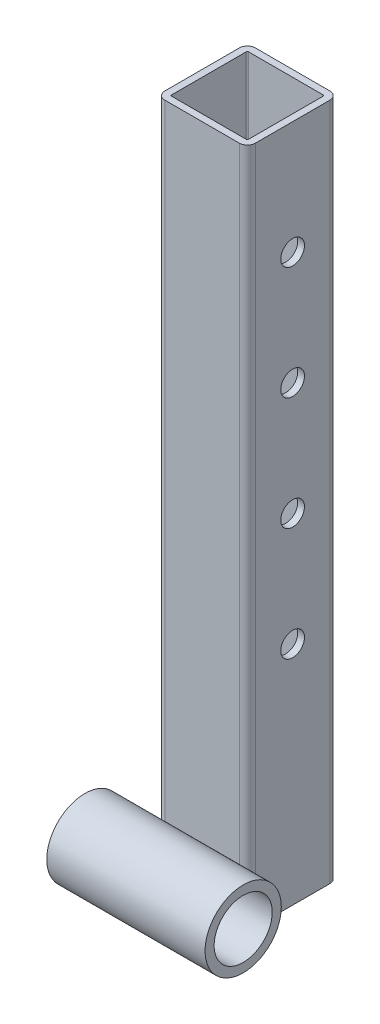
SolidWorks part; units mm, degrees
ref_plane "Plan de face" through (0, 0, 0) normal (0, 0, 1) x (1, 0, 0)
ref_plane "Plan de dessus" through (0, 0, 0) normal (0, 1, 0) x (1, 0, 0)
ref_plane "Plan de droite" through (0, 0, 0) normal (1, 0, 0) x (0, 0, -1)
sketch "Esquisse1" plane through (0, 0, 0) normal (0, 0, 1) x (1, 0, 0)
  line L0 (0, 0) -> (0, 300)
  dimension "D1" = 300
other "Elément mécano-soudé1"
ref_plane "Plan1" through (0, 0, 0) normal (0, 1, 0) x (-1, 0, 0)
sketch "Sketch1" plane through (0, 0, 0) normal (0, 1, 0) x (-1, 0, 0)
  line L0 (-16.5, -17) -> (16.5, -17)
  line L1 (-17, -16.5) -> (-17, 16.5)
  line L2 (16.5, 17) -> (-16.5, 17)
  line L3 (17, 16.5) -> (17, -16.5)
  line L4 (-16.5, -20) -> (16.5, -20)
  line L5 (-20, -16.5) -> (-20, 16.5)
  line L6 (16.5, 20) -> (-16.5, 20)
  line L7 (20, 16.5) -> (20, -16.5)
  arc A0 (20, 16.5) -> (16.5, 20) centre (16.5, 16.5) ccw
  arc A1 (16.5, -20) -> (20, -16.5) centre (16.5, -16.5) ccw
  arc A2 (-20, -16.5) -> (-16.5, -20) centre (-16.5, -16.5) ccw
  arc A3 (-16.5, 20) -> (-20, 16.5) centre (-16.5, 16.5) ccw
  arc A4 (-16.5, 17) -> (-17, 16.5) centre (-16.5, 16.5) ccw
  arc A5 (17, 16.5) -> (16.5, 17) centre (16.5, 16.5) ccw
  arc A6 (16.5, -17) -> (17, -16.5) centre (16.5, -16.5) ccw
  arc A7 (-17, -16.5) -> (-16.5, -17) centre (-16.5, -16.5) ccw
  point P0 (-20, 0)
  point P1 (20, 0)
  point P2 (0, 20)
  point P3 (0, -20)
  point P4 (0, 0)
  point P5 (-20, -20)
  point P6 (20, -20)
  point P7 (20, 20)
  point P8 (-20, 20)
  point P33 (0, 0)
  dimension "D1" = 3.5
  dimension "Thickness" = 3
  dimension "V_leg" = 40
sketch "Esquisse3" plane through (0, 0, 0) normal (1, 0, 0) x (0, 0, -1)
  line L0 (-20, 0) -> (-20, 117.696) construction
  line L1 (-20, 300) -> (-20, 0) construction
  line L2 (26.6969, 0) -> (-72.8442, 0) construction
  circle A0 centre (-36.85, 16.85) radius 12.85
  circle A1 centre (-36.85, 16.85) radius 16.85
  dimension "D1" = 33.7
  dimension "D2" = 25.7
extrude "Boss.-Extru.1" add sketch "Esquisse3" along normal blind 35 and the other way blind 35 separate body
sketch "Esquisse4" plane through (20, 0, 0) normal (1, 0, 0) x (0, 0, -1)
  line L0 (-16.5, 300) -> (16.5, 300) construction
  line L1 (0, 0) -> (0, 300) construction
  circle A0 centre (0, 250) radius 5.25
  circle A1 centre (0, 200) radius 5.25
  circle A2 centre (0, 150) radius 5.25
  circle A3 centre (0, 100) radius 5.25
  dimension "D1" = 10.5
  dimension "D2" = 50
  dimension "D4" = 50
  dimension "D3" = 4
extrude "Enlèv. mat.-Extru.1" cut sketch "Esquisse4" against normal up to next (3 mm away)
